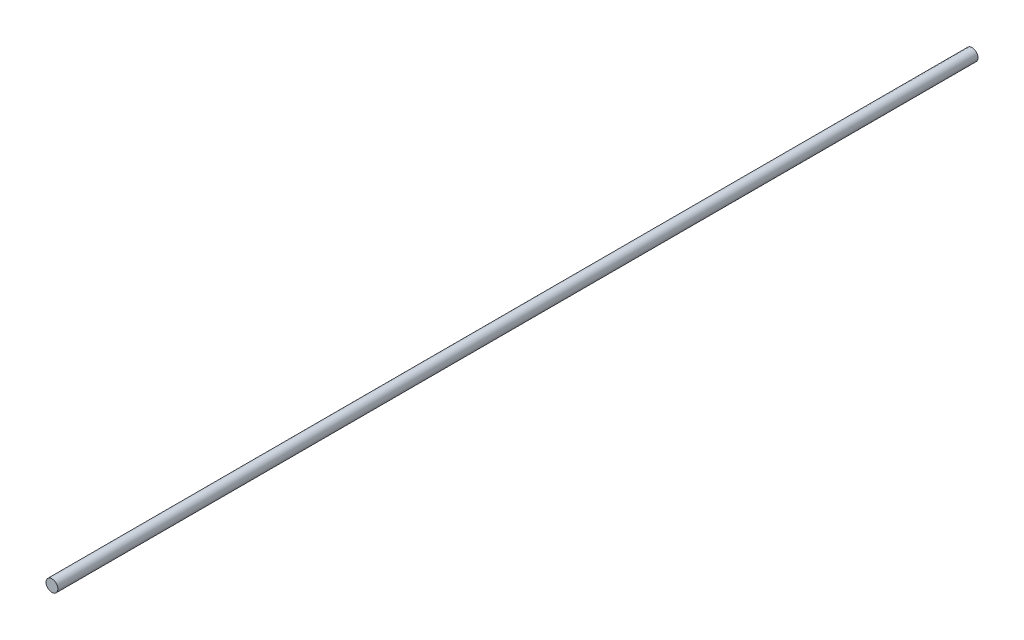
SolidWorks part; units mm, degrees
ref_plane "Front Plane" through (0, 0, 0) normal (0, 0, 1) x (1, 0, 0)
ref_plane "Top Plane" through (0, 0, 0) normal (0, 1, 0) x (1, 0, 0)
ref_plane "Right Plane" through (0, 0, 0) normal (1, 0, 0) x (0, 0, -1)
sketch "Sketch1" plane through (0, 0, 0) normal (0, 0, 1) x (1, 0, 0)
  circle A0 centre (0, 0) radius 30
  dimension "D1" = 60
extrude "Boss-Extrude1" add sketch "Sketch1" against normal blind 4650
